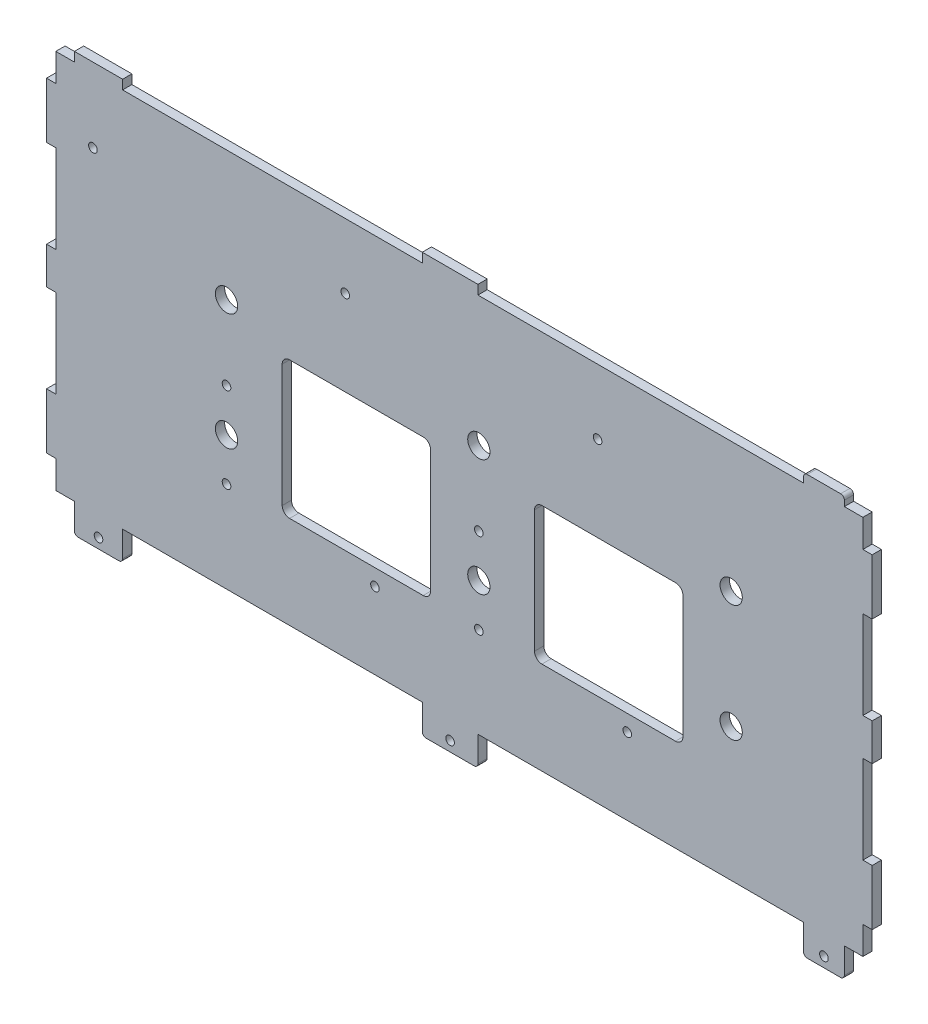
SolidWorks part; units mm, degrees
ref_plane "Front Plane" through (0, 0, 0) normal (0, 0, 1) x (1, 0, 0)
ref_plane "Top Plane" through (0, 0, 0) normal (0, 1, 0) x (1, 0, 0)
ref_plane "Right Plane" through (0, 0, 0) normal (1, 0, 0) x (0, 0, -1)
sketch "Sketch1" plane through (0, 0, 0) normal (0, 0, 1) x (1, 0, 0)
  line L0 (58.42, 45.72) -> (144.78, 45.72) construction
  line L1 (0, 0) -> (276.225, 0)
  line L2 (0, 0) -> (0, 130.175)
  line L3 (0, 130.175) -> (276.225, 130.175)
  line L4 (276.225, 0) -> (276.225, 130.175)
  line L5 (58.42, 85.725) -> (144.78, 85.725) construction
  line L6 (77.47, 31.75) -> (128.27, 31.75)
  line L7 (77.47, 31.75) -> (77.47, 78.74)
  line L8 (77.47, 78.74) -> (128.27, 78.74)
  line L9 (128.27, 31.75) -> (128.27, 78.74)
  line L10 (144.78, 45.72) -> (231.14, 45.72) construction
  line L12 (5.08, 100.33) -> (46.99, 100.33) construction
  line L13 (5.08, 100.33) -> (5.08, 7.62) construction
  line L14 (5.08, 7.62) -> (46.99, 7.62) construction
  line L15 (46.99, 100.33) -> (46.99, 7.62) construction
  line L16 (144.78, 85.725) -> (231.14, 85.725) construction
  line L18 (264.795, 7.62) -> (240.03, 7.62) construction
  line L19 (240.03, 100.33) -> (240.03, 7.62) construction
  line L20 (264.795, 100.33) -> (264.795, 7.62) construction
  line L21 (264.795, 100.33) -> (240.03, 100.33) construction
  line L22 (214.63, 31.75) -> (163.83, 31.75)
  line L23 (163.83, 31.75) -> (163.83, 78.74)
  line L24 (214.63, 31.75) -> (214.63, 78.74)
  line L25 (214.63, 78.74) -> (163.83, 78.74)
  circle A0 centre (58.42, 85.725) radius 3.81
  circle A1 centre (58.42, 45.72) radius 3.81
  circle A2 centre (144.78, 45.72) radius 3.81
  circle A3 centre (144.78, 85.725) radius 3.81
  circle A4 centre (231.14, 85.725) radius 3.81
  circle A5 centre (231.14, 45.72) radius 3.81
  dimension "D3" = 276.225
  dimension "D5" = 7.62
  dimension "D1" = 130.175
  dimension "D2" = 86.36
  dimension "D4" = 45.72
  dimension "D6" = 85.725
  dimension "D7" = 45.085
  dimension "D8" = 19.05
  dimension "D9" = 31.75
  dimension "D10" = 41.91
  dimension "D11" = 11.43
  dimension "D12" = 92.71
  dimension "D13" = 46.99
  dimension "D14" = 7.62
  dimension "D15" = 19.05
  dimension "D16" = 8.89
  dimension "D17" = 11.43
  dimension "D18" = 50.8
  dimension "D20" = 44.45
extrude "Boss-Extrude1" add sketch "Sketch1" along normal blind 3.175
fillet "Fillet1" radius 2.54 8 edges at (77.47, 31.75, 1.5875) (128.27, 31.75, 1.5875) (128.27, 78.74, 1.5875) (77.47, 78.74, 1.5875) (163.83, 31.75, 1.5875) (214.63, 31.75, 1.5875) (214.63, 78.74, 1.5875) (163.83, 78.74, 1.5875)
sketch "Sketch4" plane through (0, 0, 0) normal (0, 0, 1) x (1, 0, 0)
  line L1 (138.1125, 130.175) -> (138.1125, 0) construction
  line L6 (276.225, 130.175) -> (0, 130.175) construction
  line L7 (0, 0) -> (276.225, 0) construction
  line L8 (0, 65.0875) -> (276.225, 65.0875) construction
  line L9 (0, 130.175) -> (0, 0) construction
  line L10 (276.225, 0) -> (276.225, 130.175) construction
  line L11 (276.225, 28.575) -> (279.4, 28.575)
  line L12 (276.225, 120.65) -> (279.4, 120.65)
  line L13 (276.225, 120.65) -> (276.225, 101.6)
  line L15 (276.225, 101.6) -> (279.4, 101.6)
  line L17 (279.4, 120.65) -> (279.4, 101.6)
  line L18 (276.225, 9.525) -> (279.4, 9.525)
  line L19 (276.225, 9.525) -> (276.225, 28.575)
  line L20 (279.4, 9.525) -> (279.4, 28.575)
  line L21 (-3.175, 71.4375) -> (-3.175, 58.7375)
  line L22 (276.225, 71.4375) -> (279.4, 71.4375)
  line L23 (276.225, 71.4375) -> (276.225, 58.7375)
  line L24 (276.225, 58.7375) -> (279.4, 58.7375)
  line L25 (279.4, 71.4375) -> (279.4, 58.7375)
  line L26 (0, 58.7375) -> (-3.175, 58.7375)
  line L27 (0, 71.4375) -> (0, 58.7375)
  line L28 (0, 71.4375) -> (-3.175, 71.4375)
  line L29 (-3.175, 9.525) -> (-3.175, 28.575)
  line L30 (0, 9.525) -> (0, 28.575)
  line L31 (0, 9.525) -> (-3.175, 9.525)
  line L32 (-3.175, 120.65) -> (-3.175, 101.6)
  line L33 (0, 101.6) -> (-3.175, 101.6)
  line L34 (0, 120.65) -> (0, 101.6)
  line L35 (0, 120.65) -> (-3.175, 120.65)
  line L36 (0, 28.575) -> (-3.175, 28.575)
  line L38 (6.35, 0) -> (22.86, 0)
  line L39 (6.35, 0) -> (6.35, -10.033)
  line L43 (6.35, -10.033) -> (22.86, -10.033)
  line L44 (22.86, 0) -> (22.86, -10.033)
  line L45 (125.4125, 0) -> (144.4625, 0)
  line L46 (125.4125, 0) -> (125.4125, -10.033)
  line L47 (125.4125, -10.033) -> (144.4625, -10.033)
  line L48 (144.4625, 0) -> (144.4625, -10.033)
  line L49 (255.905, 0) -> (269.875, 0)
  line L50 (255.905, 0) -> (255.905, -10.033)
  line L51 (255.905, -10.033) -> (269.875, -10.033)
  line L52 (269.875, 0) -> (269.875, -10.033)
  line L53 (6.35, 130.175) -> (22.86, 130.175)
  line L54 (6.35, 130.175) -> (6.35, 133.35)
  line L55 (6.35, 133.35) -> (22.86, 133.35)
  line L57 (22.86, 130.175) -> (22.86, 133.35)
  line L59 (125.4125, 133.35) -> (144.4625, 133.35)
  line L60 (125.4125, 133.35) -> (125.4125, 130.175)
  line L61 (125.4125, 130.175) -> (144.4625, 130.175)
  line L62 (144.4625, 133.35) -> (144.4625, 130.175)
  line L63 (255.905, 133.35) -> (269.875, 133.35)
  line L64 (255.905, 133.35) -> (255.905, 130.175)
  line L65 (255.905, 130.175) -> (269.875, 130.175)
  line L66 (269.875, 133.35) -> (269.875, 130.175)
  point P24 (276.225, 65.0875)
  point P62 (134.9375, -10.033)
  dimension "D1" = 3.175
  dimension "D2" = 9.525
  dimension "D3" = 19.05
  dimension "D4" = 10.033
  dimension "D5" = 6.35
  dimension "D6" = 6.35
  dimension "D7" = 3.175
  dimension "D8" = 16.51
  dimension "D9" = 19.05
  dimension "D10" = 13.97
  dimension "D11" = 282.575
  dimension "D12" = 3.175
  dimension "D13" = 12.7
extrude "Boss-Extrude2" add sketch "Sketch4" along normal blind 3.175
hole_wizard "#4 Clearance Hole1" positions "Sketch3" profile "Sketch2" hole size "#4" standard "ANSI Inch"
sketch "Sketch3" plane through (0, 0, 3.175) normal (0, 0, 1) x (1, 0, 0)
  line L1 (0, 0) -> (6.35, 0) construction
  line L2 (58.42, 45.72) -> (109.22, 45.72) construction
  line L3 (144.78, 45.72) -> (195.58, 45.72) construction
  line L9 (144.4625, 0) -> (255.905, 0) construction
  line L10 (125.4125, -10.033) -> (144.4625, -10.033) construction
  line L11 (6.35, -10.033) -> (22.86, -10.033) construction
  line L12 (255.905, -10.033) -> (269.875, -10.033) construction
  line L13 (12.7, 107.95) -> (58.42, 107.95) construction
  line L15 (99.06, 107.95) -> (144.78, 107.95) construction
  line L17 (185.42, 107.95) -> (231.14, 107.95) construction
  circle A0 centre (144.78, 85.725) radius 3.81 construction
  point P0 (99.06, 107.95)
  point P15 (12.7, 107.95)
  point P22 (185.42, 107.95)
  point P28 (109.22, 26.162)
  point P32 (195.58, 26.162)
  point P40 (134.9375, -6.604)
  point P47 (14.605, -6.604)
  point P49 (262.89, -6.604)
  point P61 (58.42, 60.325)
  point P63 (58.42, 31.115)
  point P70 (144.78, 60.325)
  point P72 (144.78, 31.115)
  point P80 (134.9375, -10.033)
  point P85 (14.605, -10.033)
  point P89 (262.89, -10.033)
  dimension "D1" = 107.95
  dimension "D2" = 45.72
  dimension "D5" = 26.162
  dimension "D6" = 14.605
  dimension "2" = 50.8
  dimension "D7" = 6.604
  dimension "D8" = 29.21
sketch "Sketch2" plane through (99.06, 107.95, 3.175) normal (1, 0, 0) x (0, -1, 0)
  line L0 (0, 0) -> (0, 3.1751)
  line L1 (0, 3.1751) -> (1.4732, 3.1751)
  line L2 (1.4732, 3.1751) -> (1.4732, 0)
  line L5 (1.4732, 0) -> (0, 0)
  line L11 (0, -6.35) -> (0, 107.95) construction
  dimension "Thru Hole Dia." = 2.9464
  dimension "Thru Hole Depth" = 3.1751
fillet "Fillet2" radius 1.27 8 edges at (255.905, 133.35, 1.5875) (269.875, 133.35, 1.5875) (269.875, -10.033, 1.5875) (255.905, -10.033, 1.5875) (144.4625, -10.033, 1.5875) (125.4125, -10.033, 1.5875) (22.86, -10.033, 1.5875) (6.35, -10.033, 1.5875)
